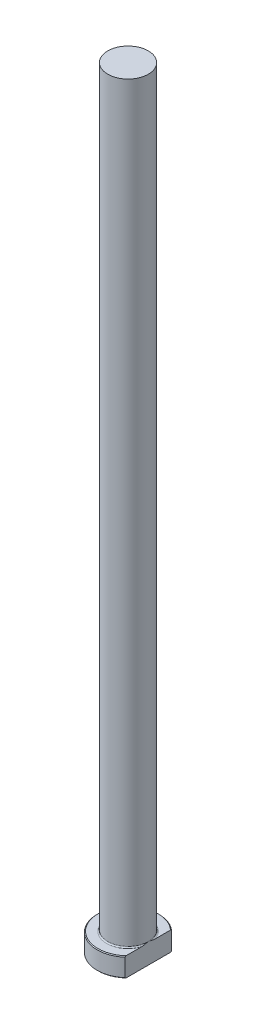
SolidWorks part; units mm, degrees
ref_plane "Front Plane" through (0, 0, 0) normal (0, 0, 1) x (1, 0, 0)
ref_plane "Top Plane" through (0, 0, 0) normal (0, 1, 0) x (1, 0, 0)
ref_plane "Right Plane" through (0, 0, 0) normal (1, 0, 0) x (0, 0, -1)
sketch "Sketch1" plane through (0, 0, 0) normal (0, 0, 1) x (1, 0, 0)
  line L0 (0, 259.9588) -> (0, -15.1925) construction
  line L1 (0, 0) -> (-8, 0)
  line L2 (-8, 0) -> (-8, 5)
  line L3 (-8, 5) -> (-5.25, 5)
  line L4 (-5.25, 5) -> (-5.25, 200)
  line L5 (-5.25, 200) -> (0, 200)
  line L6 (0, 200) -> (0, 0)
  dimension "L" = 200
  dimension "H" = 16
  dimension "T" = 5
  dimension "D" = 10.5
revolve "Revolve1" add sketch "Sketch1" angle 360 about L0
chamfer "Chamfer1" distance 0.2 angle 45 2 edges at (0, 5, 8) (0, 0, 8)
fillet "Fillet1" radius 0.3 1 edges at (0, 5, 5.25)
sketch "Sketch2" plane through (0, 0, 0) normal (0, 1, 0) x (1, 0, 0)
  line L0 (5.25, 6.0363) -> (5.25, -6.0363)
  circle A0 centre (0, 0) radius 8 construction
  arc A1 (5.25, -6.0363) -> (5.25, 6.0363) centre (0, 0) ccw
  circle A2 centre (0, 0) radius 5.25 construction
extrude "KEY" cut sketch "Sketch2" along normal through all
